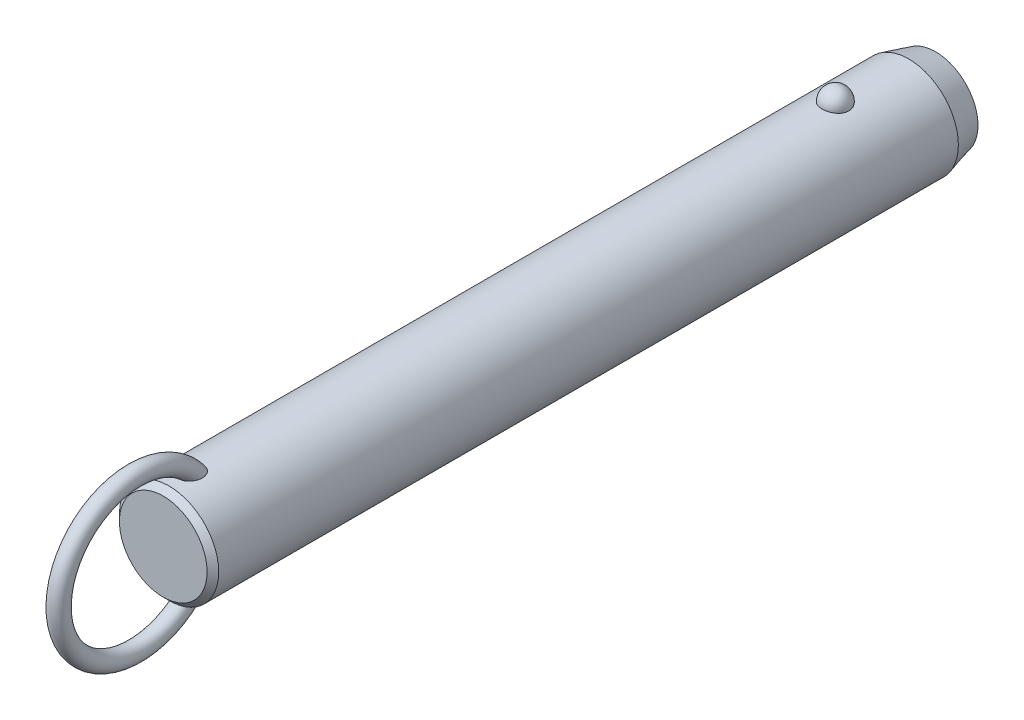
SolidWorks part; units mm, degrees
ref_plane "Front Plane" through (0, 0, 0) normal (0, 0, 1) x (1, 0, 0)
ref_plane "Top Plane" through (0, 0, 0) normal (0, 1, 0) x (1, 0, 0)
ref_plane "Right Plane" through (0, 0, 0) normal (1, 0, 0) x (0, 0, -1)
sketch "Sketch2" plane through (0, 0, 0) normal (0, 0, 1) x (1, 0, 0)
  circle A0 centre (0, 0) radius 11.1
  point P3 (0, 11.1)
  dimension "D1" = 22.2
extrude "Boss-Extrude1" add sketch "Sketch2" along normal blind 134.6
sketch "Sketch3" plane through (0, 0, 0) normal (0, 0, -1) x (-1, 0, 0)
  circle A0 centre (0, 0) radius 11.1
  dimension "D1" = 22.2
extrude "Boss-Extrude2" add sketch "Sketch3" along normal blind 25.4
chamfer "Chamfer1" distance 6 angle 15 1 edges at (-11.1, 0, -25.4)
sketch "Sketch12" plane through (0, 0, 0) normal (1, 0, 0) x (0, 0, -1)
  line L0 (-134.6, 11.1) -> (-134.6, -11.1) construction
  point P0 (-134.6, 0)
sketch "Sketch13" plane through (0, 0, 0) normal (1, 0, 0) x (0, 0, -1)
  circle A0 centre (-153.65, 0) radius 19.05
  point P2 (-134.6, 0)
  dimension "D1" = 38.1
sketch "Sketch14" plane through (0, 0, 0) normal (0, 1, 0) x (1, 0, 0)
  circle A0 centre (0, -136.6) radius 2
  point P2 (0, -134.6)
  dimension "D1" = 4
sweep "Sweep1" add profiles "Sketch14" path "Sketch13"
sketch "Sketch15" plane through (0, 0, 134.6) normal (0, 0, 1) x (1, 0, 0)
  circle A0 centre (0, 0) radius 11.1
  dimension "D1" = 22.2
extrude "Boss-Extrude3" add sketch "Sketch15" along normal blind 12.7
chamfer "Chamfer2" distance 1.3 angle 45 1 edges at (11.1, 0, 147.3)
sketch "Sketch18" plane through (0, 0, 0) normal (1, 0, 0) x (0, 0, -1)
  line L0 (19.4, 11.1) -> (-138.168, 11.1) construction
  line L1 (3, 14.1) -> (3, 8.1)
  line L2 (-138.168, -11.1) -> (19.4, -11.1) construction
  arc A0 (3, 14.1) -> (3, 8.1) centre (3, 11.1) ccw
  point P4 (0, 11.1)
  dimension "D1" = 25.2
revolve "Revolve1" add sketch "Sketch18" angle 360 about L1
